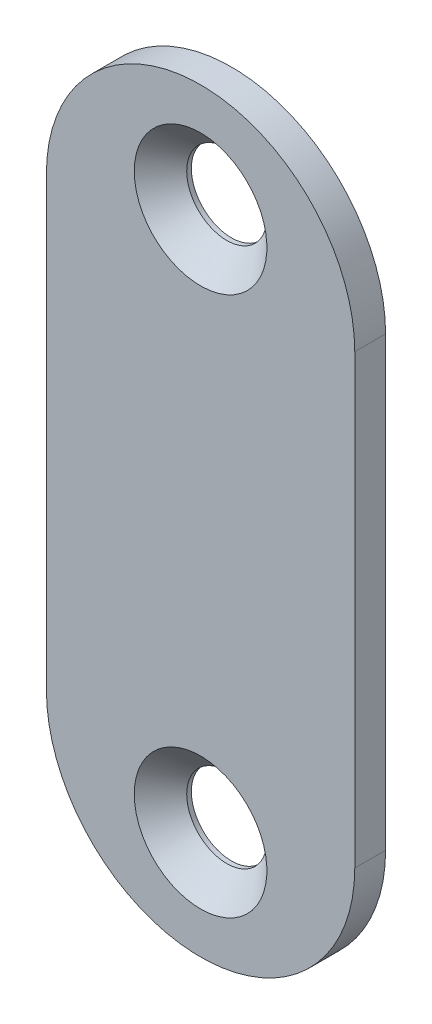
SolidWorks part; units mm, degrees
ref_plane "正面" through (0, 0, 0) normal (0, 0, 1) x (1, 0, 0)
ref_plane "平面" through (0, 0, 0) normal (0, 1, 0) x (1, 0, 0)
ref_plane "右側面" through (0, 0, 0) normal (1, 0, 0) x (0, 0, -1)
ref_plane "平面1" through (0, 0, 0) normal (0, 0, 1) x (1, 0, 0)
sketch "ｽｹｯﾁ1" plane through (0, 0, 0) normal (0, 0, 1) x (1, 0, 0)
  line L0 (10, -14.5) -> (10, 14.5)
  line L1 (-10, 14.5) -> (-10, -14.5)
  arc A0 (-10, -14.5) -> (10, -14.5) centre (0, -14.5) ccw
  arc A1 (10, 14.5) -> (-10, 14.5) centre (0, 14.5) ccw
extrude "押し出し1" add sketch "ｽｹｯﾁ1" against normal blind 2
ref_plane "平面2" through (0, 0, 0) normal (1, 0, 0) x (0, 0, -1)
sketch "ｽｹｯﾁ2" plane through (0, 0, 0) normal (1, 0, 0) x (0, 0, -1)
  line L0 (3, 17.5) -> (3, 14.9)
  line L1 (3, 14.9) -> (1.7, 14.9)
  line L2 (1.7, 14.9) -> (0, 13.2)
  line L3 (0, 13.2) -> (0, 17.5)
  line L4 (0, 17.5) -> (3, 17.5)
  line L5 (0, 17.5) -> (3, 17.5) construction
  dimension "D1" = 2.6
  dimension "D2" = 45
  dimension "D3" = 4.3
revolve "ｶｯﾄ - 回転1" cut sketch "ｽｹｯﾁ2" angle 360 about L5
ref_plane "平面3" through (0, 0, 0) normal (1, 0, 0) x (0, 0, -1)
sketch "ｽｹｯﾁ3" plane through (0, 0, 0) normal (1, 0, 0) x (0, 0, -1)
  line L0 (3, -17.5) -> (3, -20.1)
  line L1 (3, -20.1) -> (1.7, -20.1)
  line L2 (1.7, -20.1) -> (0, -21.8)
  line L3 (0, -21.8) -> (0, -17.5)
  line L4 (0, -17.5) -> (3, -17.5)
  line L5 (0, -17.5) -> (3, -17.5) construction
  dimension "D1" = 2.6
  dimension "D2" = 45
  dimension "D3" = 4.3
revolve "ｶｯﾄ - 回転2" cut sketch "ｽｹｯﾁ3" angle 360 about L5
